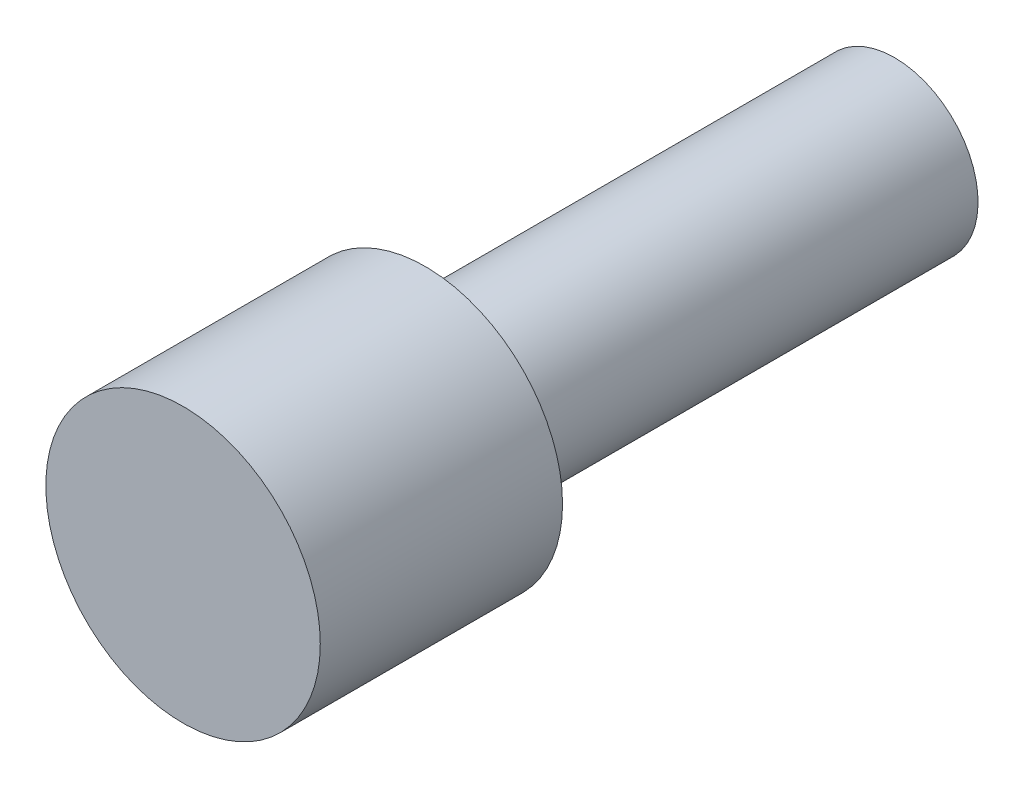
SolidWorks part; units mm, degrees
ref_plane "Front Plane" through (0, 0, 0) normal (0, 0, 1) x (1, 0, 0)
ref_plane "Top Plane" through (0, 0, 0) normal (0, 1, 0) x (1, 0, 0)
ref_plane "Right Plane" through (0, 0, 0) normal (1, 0, 0) x (0, 0, -1)
sketch "Sketch1" plane through (0, 0, 0) normal (0, 0, 1) x (1, 0, 0)
  circle A0 centre (0, 0) radius 8.1 construction
  circle A1 centre (0, 0) radius 8.1
extrude "Boss-Extrude1" add sketch "Sketch1" against normal up to vertex (14.3 mm away)
sketch "Sketch2" plane through (0, 0, -14.3) normal (0, 0, -1) x (-1, 0, 0)
  circle A0 centre (0, 0.0001) radius 4.9265
  dimension "D1" = 9.853
extrude "Boss-Extrude2" add sketch "Sketch2" along normal up to surface (27.7 mm away)
